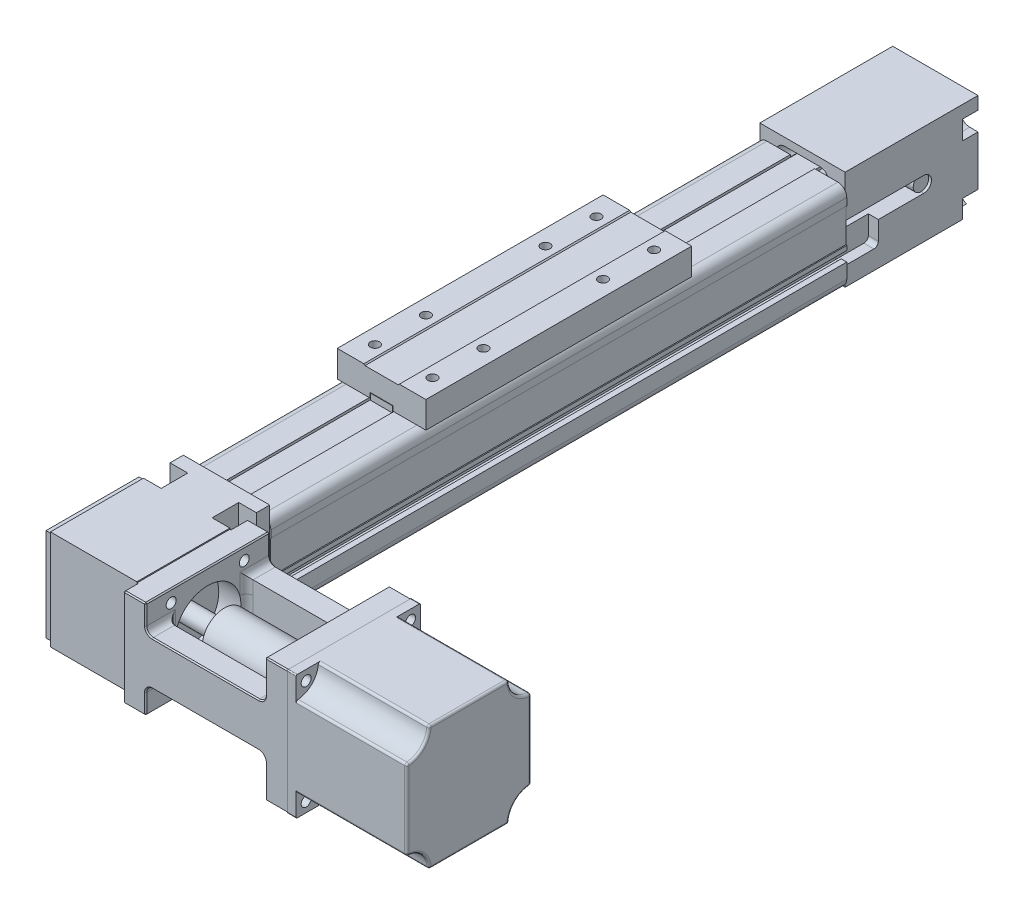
SolidWorks part; units mm, degrees
ref_plane "前视基准面" through (0, 0, 0) normal (0, 0, 1) x (1, 0, 0)
ref_plane "上视基准面" through (0, 0, 0) normal (0, 1, 0) x (1, 0, 0)
ref_plane "右视基准面" through (0, 0, 0) normal (1, 0, 0) x (0, 0, -1)
sketch "草图2" plane through (0, 0, 0) normal (0, 0, 1) x (1, 0, 0)
  line L0 (-87.6981, 0) -> (87.6981, 0) construction
  line L1 (0, -69.616) -> (0, 69.616) construction
  line L2 (-19.25, -22.5) -> (-19.25, 22.5)
  line L3 (19.25, -22.5) -> (19.25, 22.5)
  line L4 (-19.25, 22.5) -> (19.25, 22.5)
  line L5 (-19.25, -22.5) -> (19.25, -22.5)
  point P6 (0, 0)
  point P8 (-19.25, 0)
  point P12 (19.25, 0)
  dimension "D1" = 45
  dimension "D2" = 38.5
extrude "拉伸1" add sketch "草图2" along normal blind 60
sketch "草图3" plane through (0, 0, 60) normal (0, 0, 1) x (1, 0, 0)
  line L0 (0, -29.8615) -> (0, 29.8615) construction
  line L1 (-24.9311, 0) -> (24.9311, 0) construction
  line L2 (-10, -11.5956) -> (-10, 11.5956)
  line L3 (10, -11.5956) -> (10, 11.5956)
  line L4 (-7.9, 19) -> (7.9, 19)
  line L5 (-7.9, -19) -> (7.9, -19)
  arc A0 (10, 11.5956) -> (7.9, 19) centre (7.9, 15) ccw
  arc A1 (-10, 11.5956) -> (-7.9, 19) centre (-7.9, 15) cw
  arc A2 (-10, -11.5956) -> (-7.9, -19) centre (-7.9, -15) ccw
  arc A3 (10, -11.5956) -> (7.9, -19) centre (7.9, -15) cw
  point P6 (0, 0)
  point P8 (-10, 0)
  point P20 (10, 0)
  dimension "D4" = 15
  dimension "D3" = 4
  dimension "D1" = 20
  dimension "D2" = 15.8
extrude "拉伸2" cut sketch "草图3" against normal blind 52
sketch "草图4" plane through (-19.25, 0, 0) normal (-1, 0, 0) x (0, 0, 1)
  line L0 (0, 0) -> (60, 0) construction
  line L1 (60, 22.5) -> (60, -22.5) construction
  line L2 (24.5, 3.5) -> (60, 3.5)
  line L3 (24.5, -3.5) -> (60, -3.5)
  line L4 (60, -3.5) -> (60, 3.5)
  arc A0 (24.5, 3.5) -> (24.5, -3.5) centre (24.5, 0) ccw
  dimension "D1" = 7
  dimension "D2" = 35.5
extrude "拉伸3" cut sketch "草图4" against normal through all
sketch "草图5" plane through (-19.25, 0, 0) normal (-1, 0, 0) x (0, 0, 1)
  line L1 (60, -3.5) -> (45, -3.5)
  line L8 (24.5, -3.5) -> (60, -3.5) construction
  line L9 (45, -3.5) -> (45, -12)
  line L10 (47, -14) -> (60, -14)
  line L11 (60, -3.5) -> (60, -22.5) construction
  line L12 (60, -14) -> (60, -3.5)
  line L13 (60, -22.5) -> (0, -22.5) construction
  arc A1 (45, -12) -> (47, -14) centre (47, -12) ccw
  dimension "D6" = 2
  dimension "D4" = 8.5
  dimension "D5" = 15
extrude "拉伸4" cut sketch "草图5" against normal blind 4.5
mirror "镜向1" about plane through (0, 0, 0) normal (1, 0, 0) of "拉伸4"
sketch "草图6" plane through (0, 0, 0) normal (0, 0, -1) x (-1, 0, 0)
  line L0 (0, -27.6002) -> (0, 27.6002) construction
  line L1 (-19.25, 22.5) -> (19.25, 22.5) construction
  line L2 (-15.5, 12.5) -> (15.5, 12.5) construction
  line L3 (-15.5, -3) -> (15.5, -3) construction
  circle A0 centre (-15.5, 12.5) radius 2.25
  circle A1 centre (15.5, 12.5) radius 2.25
  circle A2 centre (15.5, -18.5) radius 2.25
  circle A3 centre (-15.5, -18.5) radius 2.25
  point P6 (0, 0)
  point P9 (0, 12.5)
  dimension "D4" = 4.5
  dimension "D1" = 10
  dimension "D2" = 31
  dimension "D3" = 15.5
extrude "拉伸5" cut sketch "草图6" against normal through all
sketch "草图7" plane through (0, 0, 0) normal (0, 0, -1) x (-1, 0, 0)
  line L0 (0, 0) -> (0, 25.1899) construction
  line L1 (-15.5, 16.75) -> (-19.25, 16.75)
  line L2 (-19.25, -22.5) -> (-19.25, 22.5) construction
  line L3 (-15.5, 8.25) -> (-19.25, 8.25)
  line L4 (-19.25, -22.5) -> (-19.25, 22.5) construction
  line L5 (-19.25, -22.5) -> (-19.25, 22.5) construction
  line L6 (-15.5, -14.25) -> (-19.25, -14.25)
  line L7 (19.25, -22.5) -> (14.0639, -22.5)
  line L8 (-19.25, -22.5) -> (-19.25, -14.25)
  line L9 (19.25, -22.5) -> (19.25, -14.25)
  line L10 (15.5, -14.25) -> (19.25, -14.25)
  line L12 (-19.25, 16.75) -> (-19.25, 8.25)
  line L13 (19.25, 16.75) -> (19.25, 8.25)
  line L14 (15.5, 8.25) -> (19.25, 8.25)
  line L15 (15.5, 16.75) -> (19.25, 16.75)
  line L16 (-19.25, -22.5) -> (-14.0639, -22.5)
  arc A0 (14.0639, -22.5) -> (15.5, -14.25) centre (15.5, -18.5) cw
  arc A1 (-14.0639, -22.5) -> (-15.5, -14.25) centre (-15.5, -18.5) ccw
  arc A2 (-15.5, 8.25) -> (-15.5, 16.75) centre (-15.5, 12.5) ccw
  arc A3 (15.5, 8.25) -> (15.5, 16.75) centre (15.5, 12.5) cw
  dimension "D1" = 8.5
  dimension "D2" = 8.5
extrude "拉伸6" cut sketch "草图7" against normal blind 7
sketch "草图8" plane through (0, 0, 0) normal (0, 0, -1) x (-1, 0, 0)
  line L0 (-13, 0) -> (13, 0) construction
  line L1 (0, 0) -> (0, 9.5756) construction
  circle A0 centre (-13, 0) radius 2
  circle A1 centre (13, 0) radius 2
  dimension "D2" = 4
  dimension "D1" = 26
extrude "拉伸7" cut sketch "草图8" against normal through all
sketch "草图9" plane through (0, 0, 0) normal (0, 0, -1) x (-1, 0, 0)
  line L0 (0, 0) -> (0, 8.6638) construction
  circle A0 centre (-13, 0) radius 4
  circle A1 centre (13, 0) radius 4
  dimension "D1" = 8
extrude "拉伸8" cut sketch "草图9" against normal blind 5
sketch "草图10" plane through (-19.25, 0, 0) normal (-1, 0, 0) x (0, 0, 1)
  line L0 (24.5, 3.5) -> (24.5, -3.5) construction
  point P4 (24.5, 0)
ref_plane "基准面1" through (0, 0, 24.5) normal (0, 0, 1) x (1, 0, 0)
sketch "草图11" plane through (0, 0, 24.5) normal (0, 0, 1) x (1, 0, 0)
  line L0 (-19.25, 0) -> (19.25, 0) construction
  line L1 (19.25, -3.5) -> (19.25, 3.5) construction
  line L2 (0, 22.5) -> (0, -22.5) construction
  line L3 (19.25, 22.5) -> (-19.25, 22.5) construction
  line L4 (-19.25, -22.5) -> (19.25, -22.5) construction
  line L5 (-18, 0) -> (-18, 3.5)
  line L6 (-18, 3.5) -> (-7.7, 3.5)
  line L7 (-7.7, 3.5) -> (-7.7, 16)
  line L8 (-7.7, 16) -> (-5.2, 16)
  line L9 (-5.2, 16) -> (-5.2, 15)
  line L10 (-5.2, 15) -> (5.2, 15)
  line L11 (18, 0) -> (18, 3.5)
  line L12 (18, 3.5) -> (7.7, 3.5)
  line L13 (5.2, 16) -> (5.2, 15)
  line L14 (7.7, 16) -> (5.2, 16)
  line L15 (7.7, 3.5) -> (7.7, 16)
  line L16 (-18, 0) -> (18, 0)
  point P22 (0, 15)
  dimension "D1" = 36
  dimension "D2" = 10.4
  dimension "D3" = 15.4
  dimension "D4" = 16
  dimension "D5" = 15
  dimension "D6" = 3.5
revolve "旋转1" add sketch "草图11" angle 360 about L16
ref_plane "基准面2" through (0, 0, 320) normal (0, 0, 1) x (1, 0, 0)
sketch "草图12" plane through (0, 0, 320) normal (0, 0, 1) x (1, 0, 0)
  line L0 (0, -39.1606) -> (0, 39.1606) construction
  line L1 (-32.9855, 0) -> (32.9855, 0) construction
  line L2 (-19.5, 22.5) -> (-19.5, -22.5)
  line L3 (-19.5, 22.5) -> (19.5, 22.5)
  line L4 (19.5, 22.5) -> (19.5, -22.5)
  line L5 (-19.5, -22.5) -> (19.5, -22.5)
  point P6 (0, 0)
  point P9 (0, -22.5)
  point P11 (0, 22.5)
  point P12 (19.5, 0)
  point P13 (-19.5, 0)
  dimension "D1" = 45
  dimension "D2" = 39
extrude "拉伸9" add sketch "草图12" along normal blind 60
sketch "草图13" plane through (0, 22.5, 0) normal (0, 1, 0) x (1, 0, 0)
  line L0 (0, -320) -> (0, -380) construction
  line L1 (19.5, -320) -> (-19.5, -320) construction
  line L2 (19.5, -380) -> (-19.5, -380) construction
  line L3 (19.5, -380) -> (19.5, -320) construction
  line L4 (19.5, -326) -> (11.5, -326)
  line L5 (19.5, -326) -> (19.5, -338)
  line L6 (19.5, -338) -> (11.5, -338)
  line L7 (11.5, -326) -> (11.5, -338)
  line L8 (-11.5, -326) -> (-11.5, -338)
  line L9 (-19.5, -338) -> (-11.5, -338)
  line L10 (-19.5, -326) -> (-19.5, -338)
  line L11 (-19.5, -326) -> (-11.5, -326)
  dimension "D1" = 6
  dimension "D2" = 12
  dimension "D3" = 8
extrude "拉伸10" cut sketch "草图13" against normal blind 22.3
sketch "草图15" plane through (0, -22.5, 0) normal (0, -1, 0) x (1, 0, 0)
  line L0 (0, 320) -> (0, 380) construction
  line L1 (-19.5, 320) -> (19.5, 320) construction
  line L2 (-19.5, 380) -> (19.5, 380) construction
  line L3 (-19.5, 380) -> (-19.5, 320) construction
  line L4 (-19.5, 326) -> (-10, 326)
  line L5 (-19.5, 326) -> (-19.5, 338)
  line L6 (-19.5, 338) -> (-10, 338)
  line L7 (-7, 329) -> (-7, 335)
  line L8 (7, 329) -> (7, 335)
  line L9 (19.5, 338) -> (10, 338)
  line L10 (19.5, 326) -> (19.5, 338)
  line L11 (19.5, 326) -> (10, 326)
  arc A0 (-7, 335) -> (-10, 338) centre (-10, 335) ccw
  arc A1 (-7, 329) -> (-10, 326) centre (-10, 329) cw
  arc A2 (7, 335) -> (10, 338) centre (10, 335) cw
  arc A3 (7, 329) -> (10, 326) centre (10, 329) ccw
  point P19 (-7, 338)
  point P22 (-7, 326)
  point P25 (7, 338)
  point P28 (7, 326)
  dimension "D4" = 3
  dimension "D1" = 6
  dimension "D2" = 12
  dimension "D3" = 12.5
extrude "拉伸12" cut sketch "草图15" against normal blind 6
fillet "圆角1" radius 2 2 edges at (15.5, 0.2, 338) (-15.5, 0.2, 338)
sketch "草图16" plane through (-19.5, 0, 0) normal (-1, 0, 0) x (0, 0, 1)
  line L0 (380, -22.5) -> (338, -22.5) construction
  line L1 (380, 22.5) -> (380, -22.5) construction
  line L2 (358, 0) -> (358, 11.1352) construction
  circle A0 centre (358, 0) radius 18.5
  dimension "D2" = 37
  dimension "D1" = 22
  dimension "D3" = 22.5
extrude "拉伸13" cut sketch "草图16" against normal through all
sketch "草图17" plane through (0, 0, 320) normal (0, 0, -1) x (-1, 0, 0)
  line L0 (0, 0) -> (7.3583, 0) construction
  line L1 (0, 0) -> (0, 21.2702) construction
  line L2 (-3.5, 14.5) -> (3.5, 14.5) construction
  line L3 (-3.5, -14.5) -> (3.5, -14.5) construction
  line L4 (-3.5, 18.5) -> (3.5, 18.5)
  line L5 (-3.5, 10.5) -> (3.5, 10.5)
  line L6 (-3.5, -10.5) -> (3.5, -10.5)
  line L7 (-3.5, -18.5) -> (3.5, -18.5)
  arc A0 (3.5, 10.5) -> (3.5, 18.5) centre (3.5, 14.5) ccw
  arc A1 (-3.5, 10.5) -> (-3.5, 18.5) centre (-3.5, 14.5) cw
  arc A2 (-3.5, -10.5) -> (-3.5, -18.5) centre (-3.5, -14.5) ccw
  arc A3 (3.5, -10.5) -> (3.5, -18.5) centre (3.5, -14.5) cw
  point P7 (0, 14.5)
  point P17 (0, -14.5)
  point P18 (0, -21.2702)
  dimension "D3" = 8
  dimension "D1" = 7
  dimension "D2" = 29
extrude "拉伸14" cut sketch "草图17" against normal up to next
sketch "草图18" plane through (-19.5, 0, 0) normal (-1, 0, 0) x (0, 0, 1)
  point P0 (358, 0)
ref_plane "基准面3" through (0, 0, 358) normal (0, 0, 1) x (1, 0, 0)
sketch "草图19" plane through (0, 0, 358) normal (0, 0, 1) x (1, 0, 0)
  line L0 (0, 0) -> (0, 18.6946) construction
  line L1 (0, 0) -> (-26.1714, 0) construction
  line L2 (-18, 0) -> (-18, 4)
  line L3 (-18, 4) -> (-17, 4)
  line L4 (-17, 4) -> (-17, 18.5)
  line L5 (-17, 18.5) -> (-5.2, 18.5)
  line L6 (-5.2, 18.5) -> (-5.2, 15)
  line L7 (-5.2, 15) -> (5.2, 15)
  line L8 (5.2, 18.5) -> (5.2, 15)
  line L9 (17, 18.5) -> (5.2, 18.5)
  line L10 (17, 4) -> (17, 18.5)
  line L11 (17, 4) -> (37, 4)
  line L12 (37, 4) -> (37, 10)
  line L13 (37, 10) -> (67, 10)
  line L14 (67, 10) -> (67, 0)
  line L15 (0, 0) -> (82.9604, 0) construction
  line L16 (-18, 0) -> (67, 0)
  point P12 (0, 15)
  dimension "D1" = 34
  dimension "D2" = 18
  dimension "D3" = 10.4
  dimension "D4" = 4
  dimension "D5" = 10
  dimension "D6" = 20
  dimension "D7" = 30
revolve "旋转2" add sketch "草图19" angle 360 about L16
sketch "草图20" plane through (0, 0, 0) normal (1, 0, 0) x (0, 0, -1)
  line L0 (-24.5, 0) -> (-358, 0) construction
  line L1 (-358, 15) -> (-24.5, 15)
  line L2 (-24.5, -15) -> (-345.9892, -8.9856)
  line L3 (-358, 16.2) -> (-24.5, 16.2)
  line L4 (-24.5114, -16.2) -> (-345.4116, -10.1966)
  arc A0 (-24.5, -15) -> (-24.5, 15) centre (-24.5, 0) ccw
  arc A1 (-358, 15) -> (-345.9892, -8.9856) centre (-358, 0) ccw
  arc A2 (-24.5114, -16.2) -> (-24.5, 16.2) centre (-24.5, 0) ccw
  arc A3 (-358, 16.2) -> (-345.4116, -10.1966) centre (-358, 0) ccw
  dimension "D1" = 30
  dimension "D2" = 30
  dimension "D3" = 1.2
extrude "拉伸15" add sketch "草图20" along normal mid plane 10.4
sketch "草图21" plane through (0, 0, 60) normal (0, 0, 1) x (1, 0, 0)
  line L0 (0, 0) -> (0, 31.4578) construction
  line L1 (-5.5, 17) -> (-5.5, 12)
  line L2 (5.5, 17) -> (5.5, 12)
  line L3 (-16, -23) -> (-11.01, -23)
  line L4 (-20, -19) -> (-20, 13)
  line L5 (-16, 17) -> (-5.5, 17)
  line L6 (4.5, -14.5) -> (9.5, -14.5)
  line L7 (20, -19) -> (20, 13)
  line L8 (-5.5, 12) -> (5.5, 12)
  line L9 (5.5, 17) -> (16, 17)
  line L10 (-19.5, -22.5) -> (19.5, -22.5) construction
  line L11 (-10, -15) -> (-10, -19)
  line L12 (10, -15) -> (10, -19.5)
  line L13 (-9.5, -14.5) -> (-4.5, -14.5)
  line L14 (-9.5, -19.5) -> (10, -19.5)
  line L15 (-4.5, -14) -> (4.5, -14)
  line L16 (-4.5, -14) -> (-4.5, -14.5)
  line L17 (-10.5, -22.49) -> (-11.01, -23)
  line L18 (4.5, -14) -> (4.5, -14.5)
  line L19 (11.01, -23) -> (16, -23)
  line L21 (-10.5, -22.49) -> (10.5, -22.49)
  line L23 (10.5, -22.49) -> (11.01, -23)
  arc A0 (-20, 13) -> (-16, 17) centre (-16, 13) cw
  arc A1 (20, 13) -> (16, 17) centre (16, 13) ccw
  arc A2 (16, -23) -> (20, -19) centre (16, -19) ccw
  arc A3 (-16, -23) -> (-20, -19) centre (-16, -19) cw
  arc A4 (10, -15) -> (9.5, -14.5) centre (9.5, -15) ccw
  arc A5 (-9.5, -14.5) -> (-10, -15) centre (-9.5, -15) ccw
  arc A6 (-9.5, -19.5) -> (-10, -19) centre (-9.5, -19) cw
  point P19 (-20, 17)
  point P24 (20, -23)
  point P27 (-20, -23)
  point P34 (10, -14.5)
  point P37 (-10, -14.5)
  point P40 (-10, -19.5)
  dimension "D10" = 4
  dimension "D14" = 0.5
  dimension "D1" = 40
  dimension "D2" = 0.5
  dimension "D3" = 40
  dimension "D4" = 20
  dimension "D5" = 5
  dimension "D6" = 11
  dimension "D7" = 5
  dimension "D8" = 20
  dimension "D9" = 3.5
  dimension "D11" = 9
  dimension "D12" = 5.5
  dimension "D13" = 0.5
  dimension "D17" = 0.51
extrude "拉伸17" add sketch "草图21" along normal up to surface (260 mm away)
sketch "草图22" plane through (0, 0, 60) normal (0, 0, -1) x (-1, 0, 0)
  line L0 (16, -23) -> (11.01, -23) construction
  line L1 (19.75, -5.5) -> (20, -5.75)
  line L3 (0, -3) -> (0, 12.2435) construction
  line L4 (0, -3) -> (7.163, -3) construction
  line L5 (-20, -10) -> (20, -10) construction
  line L6 (-20, -19) -> (-20, 13) construction
  line L7 (20, 13) -> (20, -19) construction
  line L8 (-20, -7.75) -> (-20, -12.25)
  line L9 (-20, -12.25) -> (-17.5, -12.25)
  line L10 (-17.5, -12.25) -> (-17.5, -13.75)
  line L11 (-17.5, -13.75) -> (-15, -13.75)
  line L12 (-15, -13.75) -> (-15, -6.25)
  line L13 (-17.5, -6.25) -> (-15, -6.25)
  line L14 (-17.5, -7.75) -> (-17.5, -6.25)
  line L15 (-20, -7.75) -> (-17.5, -7.75)
  line L16 (16, -23) -> (11.01, -23) construction
  line L17 (-20, 2) -> (20, 2) construction
  line L18 (-19.75, -5.5) -> (-19.75, 9.5)
  line L19 (-19.75, 9.5) -> (-20, 9.75)
  line L20 (-20, 9.75) -> (-20, -5.75)
  line L21 (-19.75, -5.5) -> (-20, -5.75)
  line L22 (20, 9.75) -> (20, -5.75)
  line L23 (19.75, 9.5) -> (20, 9.75)
  line L24 (19.75, -5.5) -> (19.75, 9.5)
  line L25 (20, -7.75) -> (17.5, -7.75)
  line L26 (17.5, -7.75) -> (17.5, -6.25)
  line L27 (17.5, -6.25) -> (15, -6.25)
  line L28 (15, -13.75) -> (15, -6.25)
  line L29 (17.5, -13.75) -> (15, -13.75)
  line L30 (17.5, -12.25) -> (17.5, -13.75)
  line L31 (20, -12.25) -> (17.5, -12.25)
  line L32 (20, -7.75) -> (20, -12.25)
  point P25 (-15, -10)
  point P37 (-19.75, 2)
  point P48 (19.75, 2)
  point P49 (15, -10)
  dimension "D1" = 13
  dimension "D2" = 4.5
  dimension "D3" = 7.5
  dimension "D4" = 5
  dimension "D5" = 2.5
  dimension "D6" = 20
  dimension "D7" = 15
  dimension "D8" = 135
  dimension "D9" = 39.5
extrude "拉伸19" cut sketch "草图22" against normal up to surface (260 mm away)
sketch "草图23" plane through (-19.5, 0, 0) normal (-1, 0, 0) x (0, 0, 1)
  line L0 (358, 0) -> (358, 28.9336) construction
  line L1 (358, 0) -> (368.1308, 0) construction
  line L2 (341.5, 16.5) -> (374.5, 16.5) construction
  line L3 (341.5, -16.5) -> (374.5, -16.5) construction
  point P10 (358, -16.5)
  point P11 (358, 16.5)
  dimension "D1" = 33
  dimension "D2" = 33
hole_wizard "M4 螺纹孔1" positions "3D草图1" profile "草图25" tap size "M4" standard "GB"
sketch3d "3D草图1"
  point P0 (-19.5, 16.5, 341.5)
  point P3 (-19.5, 16.5, 374.5)
  point P6 (-19.5, -16.5, 374.5)
  point P9 (-19.5, -16.5, 341.5)
sketch "草图25" plane through (-19.5, 16.5, 341.5) normal (0, 1, 0) x (0, 0, 1)
  line L0 (0, 0) -> (0, 86.5)
  line L1 (0, 86.5) -> (1.65, 86.5)
  line L2 (1.65, 86.5) -> (1.65, 0)
  line L5 (1.65, 0) -> (0, 0)
  line L11 (0, -6.35) -> (0, 107.95) construction
  dimension "通孔螺纹孔钻头直径" = 3.3
  dimension "通孔螺纹孔钻头深度" = 86.5
sketch "草图26" plane through (-19.5, 0, 0) normal (-1, 0, 0) x (0, 0, 1)
  line L0 (358, 0) -> (364.1606, 0) construction
  line L1 (358, 0) -> (358, 28.164) construction
  line L2 (337, 21) -> (379, 21)
  line L3 (337, -21) -> (379, -21)
  line L4 (379, 21) -> (379, -21)
  line L5 (337, 21) -> (337, -21)
  circle A0 centre (341.5, 16.5) radius 2.75
  circle A1 centre (341.5, -16.5) radius 2.75
  circle A2 centre (374.5, -16.5) radius 2.75
  circle A3 centre (374.5, 16.5) radius 2.75
  point P8 (358, 21)
  dimension "D3" = 5.5
  dimension "D1" = 42
  dimension "D2" = 42
extrude "拉伸20" add sketch "草图26" along normal blind 3
sketch "草图28" plane through (19.5, 0, 0) normal (1, 0, 0) x (0, 0, -1)
  line L0 (-342.7556, 0) -> (-373.2444, 0) construction
  line L1 (-358, -35.4656) -> (-358, 35.4656) construction
  line L2 (-386, 22) -> (-330, 22)
  line L3 (-330, 22) -> (-330, -22)
  line L4 (-386, 22) -> (-386, -22)
  line L5 (-386, -22) -> (-330, -22)
  circle A0 centre (-374.5, 16.5) radius 2.25
  circle A1 centre (-341.5, 16.5) radius 2.25
  circle A2 centre (-341.5, -16.5) radius 2.25
  circle A3 centre (-374.5, -16.5) radius 2.25
  circle A4 centre (-358, 0) radius 15
  point P7 (-358, 0)
  point P10 (-358, -22)
  point P12 (-358, 22)
  point P13 (-386, 0)
  point P14 (-330, 0)
  dimension "D3" = 4.5
  dimension "D4" = 30
  dimension "D1" = 44
  dimension "D2" = 56
extrude "拉伸21" add sketch "草图28" along normal blind 10
sketch "草图29" plane through (29.5, 0, 0) normal (1, 0, 0) x (0, 0, -1)
  line L0 (-358, 0) -> (-358, 30.1249) construction
  line L1 (-358, 0) -> (-370.1833, 0) construction
  line L2 (-386, -10) -> (-386, 10)
  line L3 (-386, 22) -> (-386, -22) construction
  line L4 (-386, 10) -> (-375.5, 10)
  line L5 (-386, -10) -> (-375.5, -10)
  line L6 (-330, -10) -> (-330, 10)
  line L7 (-375.5, 10) -> (-375.5, -10)
  line L9 (-340.5, 10) -> (-340.5, -10)
  line L10 (-340.5, 10) -> (-330, 10)
  line L11 (-340.5, -10) -> (-330, -10)
  point P10 (-330, 0)
  point P12 (-386, 0)
  point P13 (-358, -10)
  point P14 (-358, 10)
  dimension "D1" = 20
  dimension "D2" = 35
extrude "拉伸22" add sketch "草图29" along normal blind 54
sketch "草图30" plane through (83.5, 0, 0) normal (1, 0, 0) x (0, 0, -1)
  line L0 (-358, 0) -> (-358, 33.8524) construction
  line L1 (-358, 0) -> (-369.4629, 0) construction
  line L2 (-386, -28) -> (-386, 28)
  line L3 (-386, 10) -> (-386, -10) construction
  line L4 (-330, -28) -> (-330, 28)
  line L5 (-386, 28) -> (-330, 28)
  line L6 (-386, -28) -> (-330, -28)
  circle A0 centre (-358, 0) radius 15
  point P11 (-386, 0)
  point P13 (-346.5371, 0)
  dimension "D1" = 30
  dimension "D2" = 56
extrude "拉伸23" add sketch "草图30" along normal blind 10
sketch "草图32" plane through (93.5, 0, 0) normal (1, 0, 0) x (0, 0, -1)
  line L0 (-358, -34.6272) -> (-358, 34.6272) construction
  line L1 (-344.9899, 0) -> (-371.0101, 0) construction
  line L2 (-381.55, -23.55) -> (-381.55, 23.55) construction
  line L3 (-334.45, -23.55) -> (-334.45, 23.55) construction
  point P7 (-358, 0)
  point P10 (-381.55, 0)
  dimension "D1" = 47.1
  dimension "D2" = 47.1
hole_wizard "M4 螺纹孔2" positions "3D草图2" profile "草图33" tap size "M4" standard "GB"
sketch3d "3D草图2"
  point P0 (93.5, 23.55, 381.55)
  point P3 (93.5, 23.55, 334.45)
  point P6 (93.5, -23.55, 334.45)
  point P9 (93.5, -23.55, 381.55)
sketch "草图33" plane through (93.5, 23.55, 381.55) normal (0, 1, 0) x (0, 0, -1)
  line L0 (0, 0) -> (0, 12.4914)
  line L1 (0, 12.4914) -> (1.65, 11.5)
  line L2 (1.65, 11.5) -> (1.65, 0)
  line L5 (1.65, 0) -> (0, 0)
  line L10 (0, 12.4914) -> (-1.65, 11.5) construction
  line L11 (0, -6.35) -> (0, 107.95) construction
  dimension "螺纹孔钻头直径" = 3.3
  dimension "螺纹孔钻头深度" = 11.5
  dimension "导头角度" = 118
sketch "草图34" plane through (93.5, 0, 0) normal (1, 0, 0) x (0, 0, -1)
  circle A0 centre (-358, 0) radius 19
  dimension "D1" = 38
extrude "拉伸25" cut sketch "草图34" against normal blind 3.5
sketch "草图35" plane through (90, 0, 0) normal (1, 0, 0) x (0, 0, -1)
  circle A0 centre (-358, 0) radius 18.5
  dimension "D1" = 37
extrude "拉伸26" add sketch "草图35" along normal blind 3.5
sketch "草图36" plane through (67, 0, 0) normal (1, 0, 0) x (0, 0, -1)
  circle A0 centre (-358, 0) radius 3.175
  dimension "D1" = 6.35
extrude "拉伸27" add sketch "草图36" along normal up to next
sketch "草图37" plane through (93.5, 0, 0) normal (1, 0, 0) x (0, 0, -1)
  line L0 (-358, -33.0395) -> (-358, 33.0395) construction
  line L1 (-345.3739, 0) -> (-370.6261, 0) construction
  line L2 (-386.05, -28.05) -> (-386.05, 28.05)
  line L3 (-329.95, -28.05) -> (-329.95, 28.05)
  line L4 (-386.05, 28.05) -> (-329.95, 28.05)
  line L5 (-386.05, -28.05) -> (-329.95, -28.05)
  circle A0 centre (-381.55, 23.55) radius 2.25
  circle A1 centre (-381.55, -23.55) radius 2.25
  circle A2 centre (-334.45, -23.55) radius 2.25
  circle A3 centre (-334.45, 23.55) radius 2.25
  point P7 (-358, 0)
  point P10 (-386.05, 0)
  dimension "D3" = 4.5
  dimension "D1" = 56.1
  dimension "D2" = 56.1
extrude "拉伸28" add sketch "草图37" along normal blind 54
sketch "草图38" plane through (147.5, 0, 0) normal (1, 0, 0) x (0, 0, -1)
  line L0 (-358, 28.05) -> (-358, -28.05) construction
  line L1 (-329.95, 28.05) -> (-386.05, 28.05) construction
  line L2 (-386.05, -28.05) -> (-329.95, -28.05) construction
  line L3 (-386.05, 0) -> (-358, 0) construction
  line L4 (-386.05, 28.05) -> (-386.05, -28.05) construction
  circle A0 centre (-386.05, 28.05) radius 10
  circle A1 centre (-386.05, -28.05) radius 10
  circle A2 centre (-329.95, -28.05) radius 10
  circle A3 centre (-329.95, 28.05) radius 10
  dimension "D1" = 20
extrude "拉伸29" cut sketch "草图38" against normal blind 50
sketch "草图42" plane through (0, 16.2, 0) normal (0, 1, 0) x (1, 0, 0)
  line L0 (0, -60) -> (0, -320) construction
  line L1 (19.25, -60) -> (-19.25, -60) construction
  line L2 (19.5, -320) -> (-19.5, -320) construction
  line L3 (0, -190) -> (24.8646, -190) construction
  line L4 (-5, -130) -> (5, -130)
  line L5 (-5, -250) -> (5, -250)
  line L6 (5, -130) -> (5, -250)
  line L7 (-5, -130) -> (-5, -250)
  point P11 (0, -130)
  dimension "D1" = 10
  dimension "D2" = 120
extrude "拉伸31" add sketch "草图42" along normal blind 2.8
sketch "草图43" plane through (0, 0, 130) normal (0, 0, -1) x (-1, 0, 0)
  line L0 (0, 22.5) -> (0, -22.5) construction
  line L1 (-19.25, 22.5) -> (19.25, 22.5) construction
  line L2 (14.0639, -22.5) -> (-14.0639, -22.5) construction
  line L3 (5.25, 19.2) -> (-5.25, 19.2)
  line L4 (-5.25, 19.2) -> (-5.25, 17)
  line L5 (-5.25, 17) -> (-20, 17)
  line L6 (-20, 17) -> (-20, 29)
  line L7 (-20, 29) -> (-8, 29)
  line L8 (5.25, 19.2) -> (5.25, 17)
  line L9 (5.25, 17) -> (20, 17)
  line L10 (20, 17) -> (20, 29)
  line L11 (-8, 29) -> (-7.5, 28.5)
  line L12 (-7.5, 28.5) -> (7.5, 28.5)
  line L13 (8, 29) -> (7.5, 28.5)
  line L14 (8, 29) -> (20, 29)
  point P9 (0, 19.2)
  point P16 (0, 27)
  point P20 (0, 28.5)
  dimension "D1" = 10.5
  dimension "D2" = 12
  dimension "D3" = 3.3
  dimension "D4" = 2.2
  dimension "D5" = 40
  dimension "D6" = 15
  dimension "D7" = 45
  dimension "D8" = 0.5
extrude "拉伸32" add sketch "草图43" against normal blind 120
sketch "草图46" plane through (0, 29, 0) normal (0, 1, 0) x (1, 0, 0)
  line L0 (0, -130) -> (0, -250) construction
  line L1 (-7.5, -130) -> (7.5, -130) construction
  line L2 (-5, -250) -> (5, -250) construction
  line L3 (-28.4411, -190) -> (28.4411, -190) construction
  line L4 (-13, -163) -> (13, -163) construction
  line L5 (-13, -217) -> (13, -217) construction
  line L6 (-13, -140) -> (13, -140) construction
  line L7 (-13, -240) -> (13, -240) construction
  point P9 (0, -190)
  point P12 (0, -163)
  point P17 (0, -142.2228)
  dimension "D1" = 54
  dimension "D2" = 26
  dimension "D3" = 23
hole_wizard "M5 螺纹孔1" positions "3D草图3" profile "草图47" tap size "M5" standard "GB"
sketch3d "3D草图3"
  point P0 (-13, 29, 240)
  point P3 (-13, 29, 217)
  point P6 (-13, 29, 163)
  point P9 (-13, 29, 140)
  point P12 (13, 29, 140)
  point P15 (13, 29, 163)
  point P18 (13, 29, 217)
  point P21 (13, 29, 240)
sketch "草图47" plane through (-13, 29, 240) normal (1, 0, 0) x (0, 0, 1)
  line L0 (0, 0) -> (0, 11.2618)
  line L1 (0, 11.2618) -> (2.1, 10)
  line L2 (2.1, 10) -> (2.1, 0)
  line L5 (2.1, 0) -> (0, 0)
  line L10 (0, 11.2618) -> (-2.1, 10) construction
  line L11 (0, -6.35) -> (0, 107.95) construction
  dimension "螺纹孔钻头直径" = 4.2
  dimension "螺纹孔钻头深度" = 10
  dimension "导头角度" = 118
fillet "圆角5" radius 1 8 edges at (122.5, 28.05, 339.95) (122.5, 18.05, 329.95) (122.5, -18.05, 329.95) (122.5, -28.05, 339.95) (122.5, -28.05, 376.05) (122.5, -18.05, 386.05) (122.5, 18.05, 386.05) (122.5, 28.05, 376.05)
fillet "圆角6" radius 1 16 edges at (147.5, 27.7885, 340.2303) (147.5, 28.05, 358) (147.5, 27.7885, 375.7697) (147.5, 20.9789, 378.9789) (147.5, 17.7697, 385.7885) (147.5, 0, 386.05) (147.5, -17.7697, 385.7885) (147.5, -20.9789, 378.9789) (147.5, -27.7885, 375.7697) (147.5, -28.05, 358) (147.5, -27.7885, 340.2303) (147.5, -20.9789, 337.0211) (147.5, -17.7697, 330.2115) (147.5, 0, 329.95) (147.5, 17.7697, 330.2115) (147.5, 20.9789, 337.0211)
fillet "圆角7" radius 3 12 edges at (83.5, 0, 375.5) (29.5, 0, 375.5) (83.5, 0, 340.5) (29.5, 0, 340.5) (29.5, 10, 380.75) (29.5, -10, 380.75)
chamfer "倒角1" distance 0.5 angle 45 48 edges at (56.5, -10, 340.5) (56.5, -10, 375.5) (29.5, 17.5, 386) (29.5, 22, 358) (83.5, 28, 358) (24.5, -22, 330) (24.5, -22, 386) (29.5, -22, 358) (83.5, -28, 358) (56.5, 10, 375.5) (82.6213, 10.8787, 374.6213) (30.3787, 10.8787, 374.6213) (82.6213, -10.8787, 341.3787) (30.3787, -10.8787, 341.3787) (82.6213, -10.8787, 374.6213) (30.3787, -10.8787, 374.6213) (30.3787, 10.8787, 330) (30.3787, 10.8787, 386) (82.6213, 10.8787, 330) (82.6213, 10.8787, 386) (29.5, -17.5, 386) (30.3787, -10.8787, 330) (30.3787, -10.8787, 386) (82.6213, -10.8787, 330) (82.6213, -10.8787, 386) (24.5, 22, 330) (24.5, 22, 386) (88.5, 28, 330) (88.5, 28, 386) (88.5, -28, 330) (88.5, -28, 386) (19.5, 11.1, 330) (19.5, -19.25, 330) (19.5, -22, 383) (19.5, -22, 334) (19.5, 22, 334) (19.5, 22, 383) (19.5, 0, 386)
fillet "圆角9" radius 0.5 4 edges at (95.5, -28.05, 329.95) (95.5, -28.05, 386.05) (95.5, 28.05, 329.95) (95.5, 28.05, 386.05)
sketch "草图49" plane through (0, -7.75, 0) normal (0, -1, 0) x (1, 0, 0)
  line L0 (-15, 62) -> (-15, 102)
  line L2 (-15, 102) -> (-30, 102)
  line L3 (-30, 102) -> (-30, 62)
  line L4 (-15, 62) -> (-30, 62)
  line L6 (0, 60) -> (0, 109.7946) construction
extrude "拉伸36" [suppressed] add sketch "草图49" along normal blind 15.25
sketch "草图50" plane through (0, 29, 0) normal (0, 1, 0) x (1, 0, 0)
  line L0 (0, -130) -> (0, -250) construction
  line L1 (-7.5, -130) -> (7.5, -130) construction
  line L2 (-5, -250) -> (5, -250) construction
  point P6 (0, -190)
ref_plane "基准面4" through (0, 0, 190) normal (0, 0, 1) x (1, 0, 0)
sketch "草图53" [suppressed] plane through (0, -7.75, 0) normal (0, 1, 0) x (1, 0, 0)
  line L0 (0, -60) -> (0, -120) construction
  line L1 (19.25, -60) -> (-19.25, -60) construction
  line L2 (-25, -62) -> (-25, -102) construction
  line L3 (-30, -62) -> (-20, -62) construction
  line L4 (-20, -102) -> (-30, -102) construction
  line L5 (-30, -82) -> (-42.2666, -82) construction
  line L6 (-30, -102) -> (-30, -62) construction
  line L7 (-25, -69) -> (-40.0744, -69) construction
  line L8 (-25, -95) -> (-40.0744, -95) construction
  dimension "D1" = 25
  dimension "D2" = 26
hole_wizard "M5 螺纹孔3" positions "3D草图5" profile "草图54" tap size "M5" standard "GB"
sketch3d "3D草图5" [suppressed]
  point P0 (-25, -7.75, 69)
  point P3 (-25, -7.75, 95)
sketch "草图54" plane through (-25, -7.75, 69) normal (1, 0, 0) x (0, 0, 1)
  line L0 (0, 0) -> (0, 20.3)
  line L1 (0, 20.3) -> (2.1, 20.3)
  line L2 (2.1, 20.3) -> (2.1, 0)
  line L5 (2.1, 0) -> (0, 0)
  line L11 (0, -6.35) -> (0, 107.95) construction
  dimension "通孔螺纹孔钻头直径" = 4.2
  dimension "通孔螺纹孔钻头深度" = 20.3
mirror "镜向2" [suppressed] about plane through (0, 0, 190) normal (0, 0, 1)
mirror "镜向3" [suppressed] about plane through (0, 0, 0) normal (1, 0, 0)
